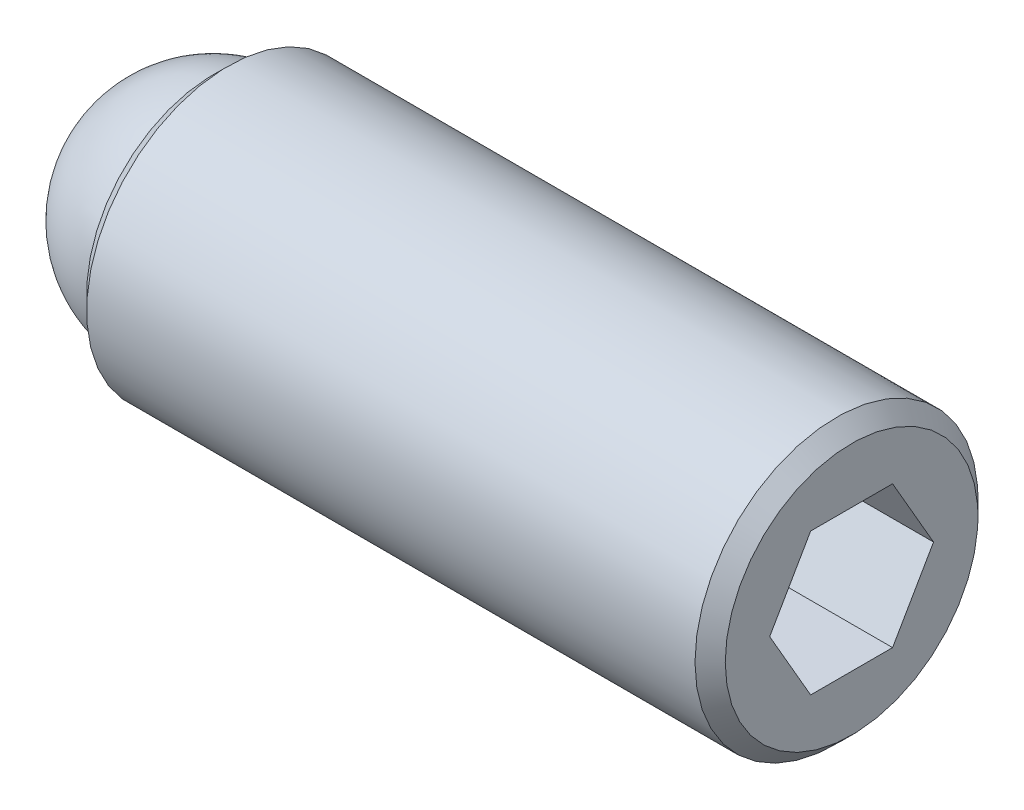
SolidWorks part; units mm, degrees
ref_plane "Front Plane" through (0, 0, 0) normal (0, 0, 1) x (1, 0, 0)
ref_plane "Top Plane" through (0, 0, 0) normal (0, 1, 0) x (1, 0, 0)
ref_plane "Right Plane" through (0, 0, 0) normal (1, 0, 0) x (0, 0, -1)
sketch "Sketch2" plane through (0, 0, 0) normal (1, 0, 0) x (0, 0, -1)
  circle A0 centre (0, 0) radius 2.3749
  dimension "D1" = 4.7498
extrude "Boss-Extrude1" add sketch "Sketch2" along normal blind 10.7156
sketch "Sketch3" plane through (0, 0, 0) normal (-1, 0, 0) x (0, 0, 1)
  circle A0 centre (0, 0) radius 1.9812
  dimension "D1" = 3.9624
chamfer "Chamfer1" distance 0.254 angle 45 1 edges at (0, 0, -2.3749)
chamfer "Chamfer2" distance 0.254 angle 45 1 edges at (10.7156, 0, -2.3749)
sketch "Sketch4" plane through (10.7156, 0, 0) normal (1, 0, 0) x (0, 0, -1)
  line L1 (1.3748, 0) -> (0.6874, 1.1906)
  line L2 (0.6874, 1.1906) -> (-0.6874, 1.1906)
  line L3 (-0.6874, 1.1906) -> (-1.3748, 0)
  line L4 (-1.3748, 0) -> (-0.6874, -1.1906)
  line L5 (-0.6874, -1.1906) -> (0.6874, -1.1906)
  line L6 (0.6874, -1.1906) -> (1.3748, 0)
  circle A0 centre (0, 0) radius 1.1906 construction
  dimension "D1" = 2.3813
extrude "Cut-Extrude2" cut sketch "Sketch4" against normal blind 2.286
extrude "Cut-Extrude3" cut sketch "Sketch3" against normal blind 1.9844
sketch "Sketch5" plane through (0, 0, 0) normal (-1, 0, 0) x (0, 0, 1)
  line L0 (0, 0) -> (0, -1.9844)
  line L1 (0, 0) -> (0, 1.9844)
  arc A0 (0, 1.9844) -> (0, -1.9844) centre (0, 0) ccw
  dimension "D1" = 1.9844
revolve "Revolve1" add sketch "Sketch5" angle 360 about L1
sketch "Sketch6" plane through (0, 0, 0) normal (-1, 0, 0) x (0, 0, 1)
  line L0 (0, 0) -> (0, 1.9844) construction
  arc A0 (0.0634, 1.9802) -> (-0.0634, 1.9802) centre (0, 0) ccw
  circle A1 centre (0, 0) radius 1.9844 construction
  arc A2 (0.0634, 1.9802) -> (-0.0634, 1.9802) centre (0, 1.9844) ccw
  dimension "D1" = 0.127
  dimension "D2" = 3.9624
extrude "Cut-Extrude5" cut sketch "Sketch6" against normal up to surface (1.9844 mm away)
